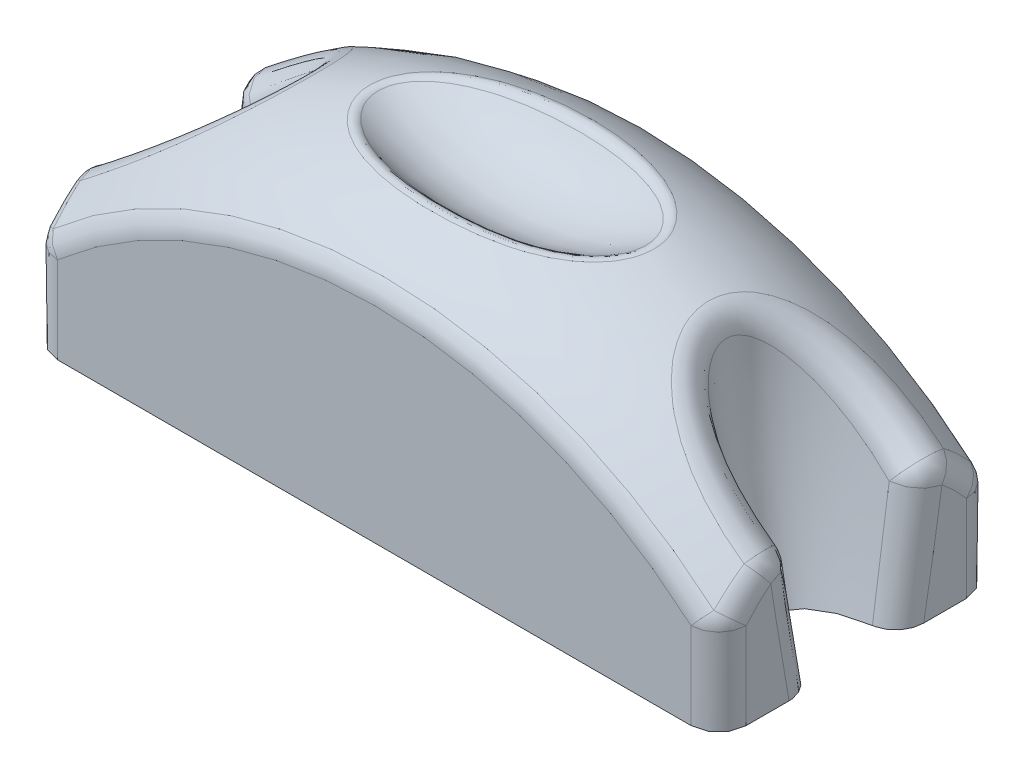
SolidWorks part; units mm, degrees
ref_plane "Front" through (0, 0, 0) normal (0, 0, 1) x (1, 0, 0)
ref_plane "Top" through (0, 0, 0) normal (0, 1, 0) x (1, 0, 0)
ref_plane "Right" through (0, 0, 0) normal (1, 0, 0) x (0, 0, -1)
sketch "Sketch1" plane through (0, 0, 0) normal (0, 1, 0) x (1, 0, 0)
  line L0 (62.5, 25) -> (-62.5, -25) construction
  line L1 (62.5, -25) -> (-62.5, -25)
  line L2 (62.5, -25) -> (62.5, 25)
  line L3 (62.5, 25) -> (-62.5, 25)
  line L4 (-62.5, -25) -> (-62.5, 25)
  dimension "D1" = 125
  dimension "D2" = 50
extrude "Extrude1" add sketch "Sketch1" along normal blind 50
sketch "Sketch2" plane through (0, 0, 0) normal (0, 0, 1) x (1, 0, 0)
  line L0 (62.5, 50) -> (62.5, 0) construction
  line L2 (-62.5, 0) -> (62.5, 0) construction
  line L4 (-62.5, 50) -> (-62.5, 0) construction
  arc A0 (62.5, 28) -> (-62.5, 28) centre (0, -50.0625) ccw
  dimension "D2" = 100
  dimension "D1" = 28
ref_plane "Plane1" through (62.5, 28, 0) normal (-0.7806, 0.625, 0) x (0, 0, 1)
sketch "Sketch3" plane through (62.5, 28, 0) normal (-0.7806, 0.625, 0) x (0, 0, 1)
  line L0 (-25, 17.1737) -> (-25, -60.9513) construction
  line L1 (25, -60.9513) -> (25, 17.1737) construction
  line L3 (-25, -10.5051) -> (-35.5007, -10.5051)
  line L4 (-35.5007, -10.5051) -> (-35.5007, 40.6396)
  line L5 (-35.5007, 40.6396) -> (37.2927, 40.6396)
  line L6 (37.2927, 40.6396) -> (37.2927, -10.5051)
  line L7 (37.2927, -10.5051) -> (25, -10.5051)
  arc A0 (-25, -10.5051) -> (25, -10.5051) centre (0, -35) cw
  dimension "D1" = 35
sweep "Cut-Sweep1" cut profiles "Sketch3" path "Sketch2"
sketch "Sketch4" plane through (0, 0, 0) normal (0, 1, 0) x (1, 0, 0)
  line L1 (62.5, -25) -> (62.5, 25) construction
  ellipse E0 centre (62.5, 0) end of major axis (47.5, 0) minor radius 7.5
  dimension "D1" = 30
  dimension "D2" = 15
ref_plane "Plane2" through (0, 50, 0) normal (0, 1, 0) x (-1, 0, 0)
sketch "Sketch5" plane through (0, 50, 0) normal (0, 1, 0) x (-1, 0, 0)
  line L0 (-62.5, 25) -> (-62.5, -25) construction
  ellipse E0 centre (-62.5, 0) end of major axis (-38.5, 0) minor radius 15
  dimension "D1" = 48
  dimension "D2" = 30
sketch "Sketch6" plane through (0, 0, 0) normal (0, 0, 1) x (1, 0, 0)
  arc A0 (47.5, 0) -> (38.5, 50) centre (178.4987, 49.3898) cw
  dimension "D1" = 140
loft "Cut-Loft2" cut profiles "Sketch4", "Sketch5"
mirror "Mirror1" about plane through (0, 0, 0) normal (1, 0, 0)
sketch "Sketch7" plane through (0, 0, 0) normal (0, 0, 1) x (1, 0, 0)
  arc A0 (-25, 46.7621) -> (25, 46.7621) centre (0, 90.0634) ccw
  arc A2 (38.6859, 42.1514) -> (-38.6859, 42.1514) centre (0, -50.0625) ccw construction
  dimension "D1" = 50
  dimension "D2" = 50
ref_plane "Plane3" through (-25, 46.7621, 0) normal (0.866, -0.5, 0) x (0, 0, -1)
sketch "Sketch8" plane through (-25, 46.7621, 0) normal (0.866, -0.5, 0) x (0, 0, -1)
  line L0 (-15, 15) -> (-26.5058, 15)
  line L1 (-26.5058, 15) -> (-26.5058, 28.2288)
  line L2 (-26.5058, 28.2288) -> (30.6363, 28.2288)
  line L3 (30.6363, 28.2288) -> (30.6363, 15)
  line L4 (30.6363, 15) -> (15, 15)
  arc A0 (-15, 15) -> (15, 15) centre (0, 15) ccw
  dimension "D1" = 15
  dimension "D2" = 30
  dimension "D3" = 15
sweep "Cut-Sweep2" cut profiles "Sketch8" path "Sketch7"
fillet "Fillet1" radius 5
fillet "Fillet2" radius 2
shell "Shell1" thickness 1.5
